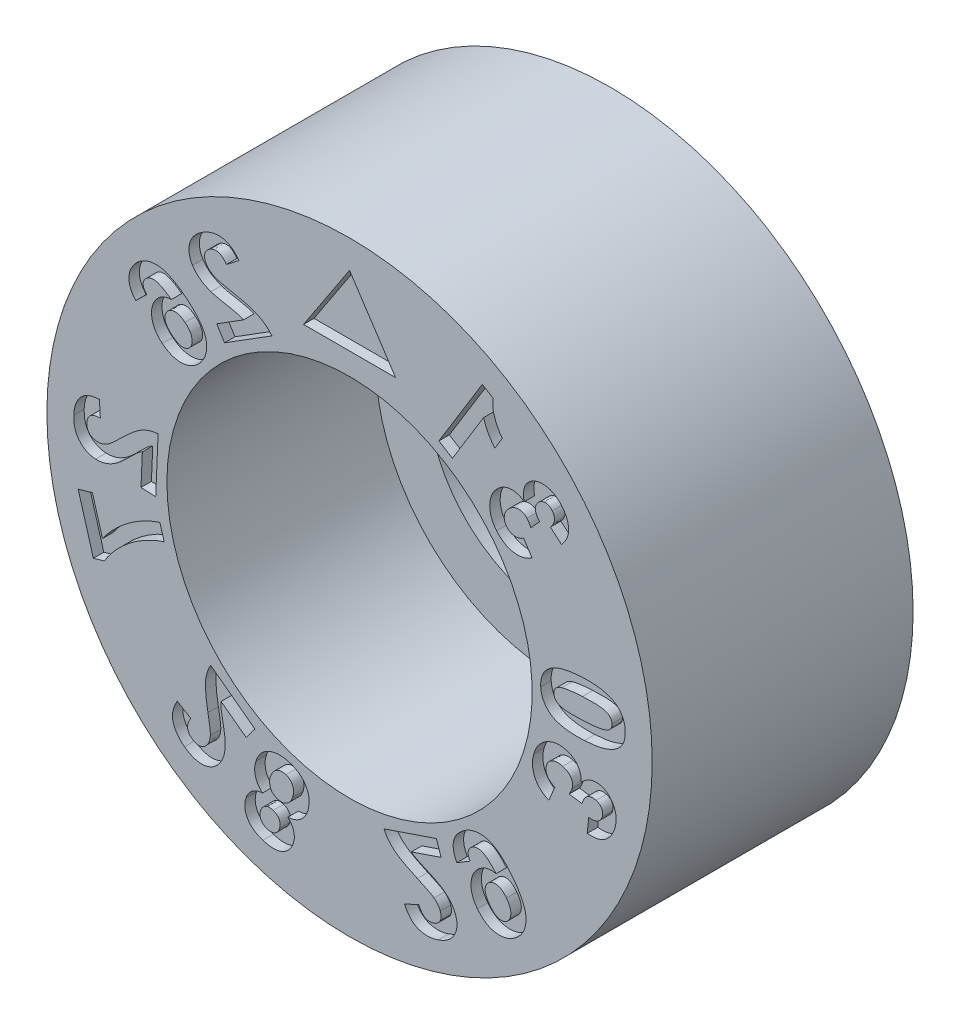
SolidWorks part; units mm, degrees
ref_plane "Front Plane" through (0, 0, 0) normal (0, 0, 1) x (1, 0, 0)
ref_plane "Top Plane" through (0, 0, 0) normal (0, 1, 0) x (1, 0, 0)
ref_plane "Right Plane" through (0, 0, 0) normal (1, 0, 0) x (0, 0, -1)
imported_body "Imported1"
other "Move Face2" parameters "D1"=0.157
other "DeleteFace1"
sketch "Sketch1" plane through (0, 0, 0) normal (0, 0, 1) x (1, 0, 0)
  arc A0 (-0.7207, 1.729) -> (0.7207, 1.729) centre (0, 0) ccw construction
  text T3 "26  27  28  29  30  31" font "Arial" height 0.8
extrude "Cut-Extrude1" cut sketch "Sketch1" against normal blind 0.1
other "Move Face3" parameters "D1"=0.5
sketch "Sketch2" plane through (0, 0, 0) normal (0, 1, 0) x (1, 0, 0)
  line L0 (2.9, 2.5) -> (-2.9, 2.5) construction
  line L1 (-1.8, 2.5) -> (-2.2, 2.5)
  arc A0 (-2.2, 2.5) -> (-1.8, 2.5) centre (-2, 2.5) cw
  dimension "D1" = 0.2
  dimension "D2" = 2
revolve "Revolve1" add sketch "Sketch2" angle 360 about L1
